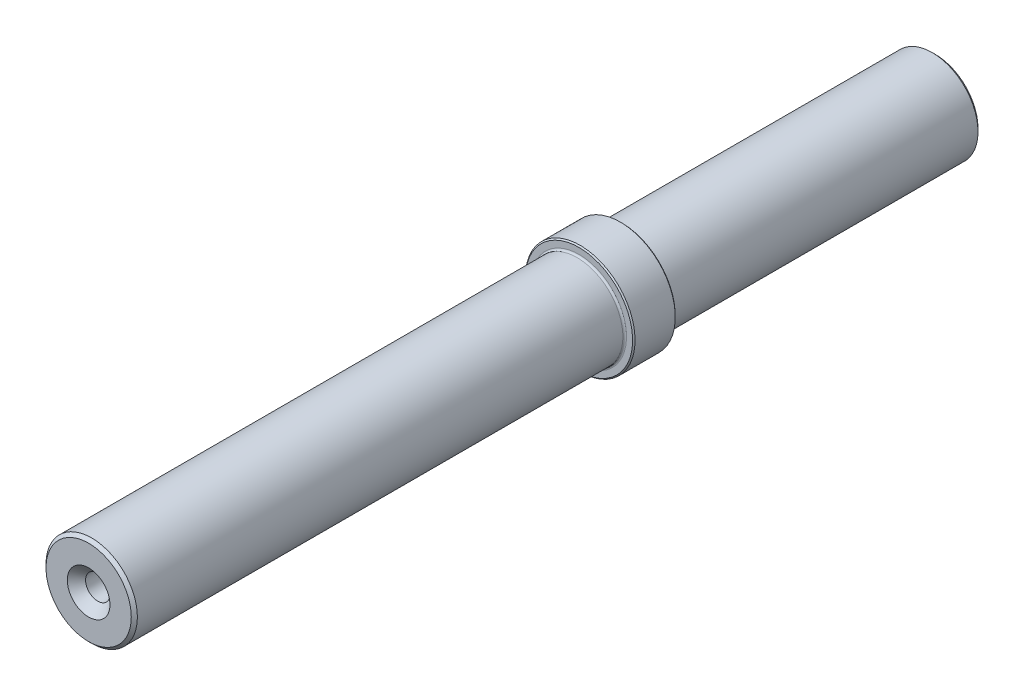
SolidWorks part; units mm, degrees
ref_plane "前视基准面" through (0, 0, 0) normal (0, 0, 1) x (1, 0, 0)
ref_plane "上视基准面" through (0, 0, 0) normal (0, 1, 0) x (1, 0, 0)
ref_plane "右视基准面" through (0, 0, 0) normal (1, 0, 0) x (0, 0, -1)
sketch "草图1" plane through (0, 0, 0) normal (0, 0, 1) x (1, 0, 0)
  circle A0 centre (0, 0) radius 7.5
  dimension "D1" = 15
extrude "凸台-拉伸1" add sketch "草图1" along normal blind 139
ref_plane "基准面1" through (7.5, 0, 0) normal (1, 0, 0) x (0, 0, -1)
ref_plane "基准面2" through (0, 0, 51.5) normal (0, 0, -1) x (-1, 0, 0)
sketch "草图3" plane through (0, 0, 51.5) normal (0, 0, -1) x (-1, 0, 0)
  circle A0 centre (0, 0) radius 9
  dimension "D1" = 18
extrude "凸台-拉伸3" add sketch "草图3" against normal blind 7
hole_wizard "M5 螺纹孔1" positions "草图6" profile "草图7" tap size "M5" standard "GB"
sketch "草图6" plane through (0, 0, 0) normal (0, 0, -1) x (-1, 0, 0)
  point P0 (0, 0)
sketch "草图7" plane through (0, 0, 0) normal (1, 0, 0) x (0, 1, 0)
  line L0 (0, 0) -> (0, 13.6618)
  line L1 (0, 13.6618) -> (2.1, 12.4)
  line L2 (2.1, 12.4) -> (2.1, 0.425)
  line L3 (2.1, 0.425) -> (2.525, 0)
  line L5 (2.525, 0) -> (0, 0)
  line L6 (-2.1, 0.425) -> (-2.525, 0) construction
  line L10 (0, 13.6618) -> (-2.1, 12.4) construction
  line L11 (0, -6.35) -> (0, 107.95) construction
  dimension "螺纹孔钻头直径" = 4.2
  dimension "螺纹孔钻头深度" = 12.4
  dimension "近端锥形沉头孔直径" = 5.05
  dimension "近端锥形沉头孔角度" = 90
  dimension "导头角度" = 118
hole_wizard "Ø4.0 (4) 直径孔1" positions "草图8" profile "草图10" hole size "Ø4.0" standard "GB"
sketch "草图8" plane through (0, 0, 139) normal (0, 0, 1) x (1, 0, 0)
  point P0 (0, 0)
sketch "草图10" plane through (0, 0, 139) normal (1, 0, 0) x (0, -1, 0)
  line L0 (0, 0) -> (0, 16.2017)
  line L1 (0, 16.2017) -> (2, 15)
  line L2 (2, 15) -> (2, 1.5)
  line L3 (2, 1.5) -> (3.5, 0)
  line L5 (3.5, 0) -> (0, 0)
  line L6 (-2, 1.5) -> (-3.5, 0) construction
  line L10 (0, 16.2017) -> (-2, 15) construction
  line L11 (0, -6.35) -> (0, 107.95) construction
  dimension "孔直径" = 4
  dimension "孔深度" = 15
  dimension "近端锥形沉头孔直径" = 7
  dimension "近端锥形沉头孔角度" = 90
  dimension "导头角度" = 118
chamfer "倒角1" [suppressed] distance 0.3 angle 45
ref_plane "基准面3" through (0, 0, 97) normal (0, 0, -1) x (-1, 0, 0)
chamfer "倒角2" distance 0.2 angle 45 2 edges at (-9, 0, 58.5) (-9, 0, 51.5)
fillet "圆角1" radius 0.3 2 edges at (-7.5, 0, 58.5) (-7.5, 0, 51.5)
ref_plane "基准面4" through (9, 0, 0) normal (1, 0, 0) x (0, 0, -1)
sketch "草图11" plane through (9, 0, 0) normal (1, 0, 0) x (0, 0, -1)
  line L0 (-58.3, 0) -> (-51.7, 0) construction
  line L1 (-38, 0) -> (-72, 0) construction
  line L2 (-38, -3) -> (-72, -3)
  line L3 (-38, 3) -> (-72, 3)
  line L4 (-55, -9) -> (-55, 13.9878) construction
  line L5 (-58.3, -9) -> (-51.7, -9) construction
  arc A0 (-38, -3) -> (-38, 3) centre (-38, 0) ccw
  arc A1 (-72, 3) -> (-72, -3) centre (-72, 0) ccw
  point P5 (-55, 0)
  dimension "D1" = 6
  dimension "D2" = 34
extrude "切除-拉伸1" [suppressed] cut sketch "草图11" against normal blind 3.5
chamfer "倒角3" distance 0.5 angle 45 2 edges at (7.5, 0, 0) (7.5, 0, 139)
